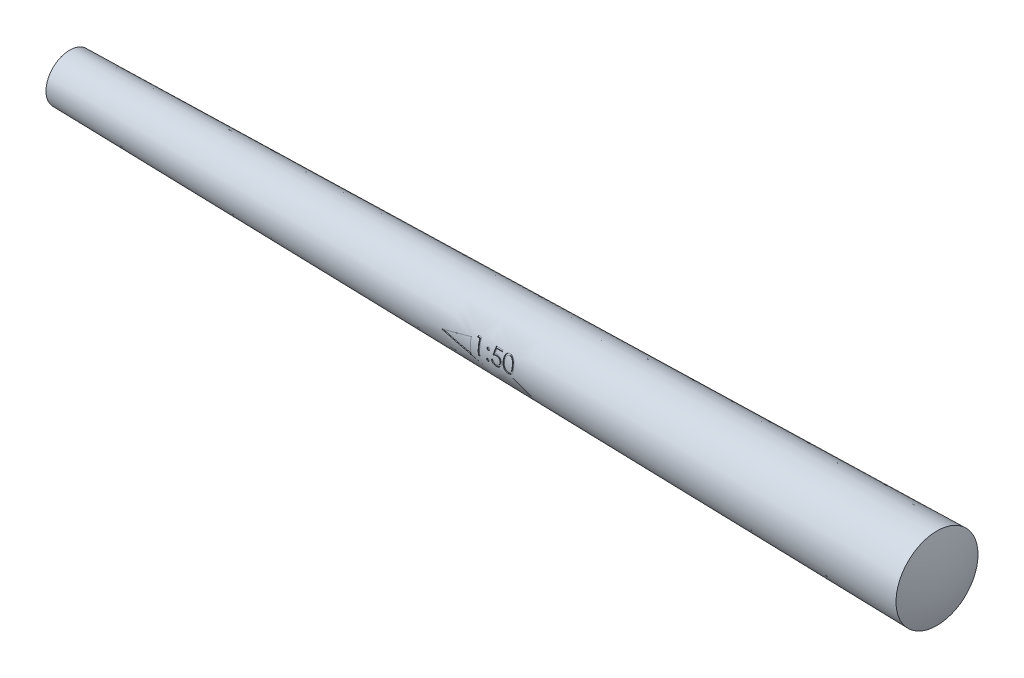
SolidWorks part; units mm, degrees
ref_plane "Front Plane" through (0, 0, 0) normal (0, 0, 1) x (1, 0, 0)
ref_plane "Top Plane" through (0, 0, 0) normal (0, 1, 0) x (1, 0, 0)
ref_plane "Right Plane" through (0, 0, 0) normal (1, 0, 0) x (0, 0, -1)
sketch "Sketch1" plane through (0, 0, 0) normal (1, 0, 0) x (0, 0, -1)
  circle A0 centre (0, 0) radius 1.5
  dimension "D1" = 3
extrude "Extrude1" add sketch "Sketch1" along normal mid plane 55
draft "Draft1" type of draft neutral plane draft angle 1.146 faces to draft 1 parameters "D1"=1.146
sketch "Sketch2" plane through (0, 0, 0) normal (0, 0, 1) x (1, 0, 0)
  line L0 (-27.5, 0) -> (-27.5, 1.5)
  line L1 (-27.5, 1.5) -> (-27.5, -1.5) construction
  line L2 (-27.5, 0) -> (-27.95, 0)
  line L3 (-27.95, 0) -> (-27.95, -2.05) construction
  line L4 (27.5, 0) -> (27.5, 2.6)
  line L5 (27.5, -2.6) -> (27.5, 2.6) construction
  line L6 (27.5, 0) -> (27.95, 0)
  line L7 (27.95, 0) -> (27.95, -2.05) construction
  line L8 (-27.5, -1.5) -> (27.5, -2.6) construction
  arc A0 (-27.95, 0) -> (-27.5, 1.5) centre (-25.225, 0) cw
  arc A1 (27.95, 0) -> (27.5, 2.6) centre (20.2137, 0) ccw
  point P14 (0, -2.05)
revolve "Revolve1" add sketch "Sketch2" angle 360 about L2
sketch "Sketch5" plane through (0, 0, 0) normal (0, 0, 1) x (1, 0, 0)
  line L0 (0, 2.05) -> (0, -2.05) construction
  line L1 (27.5, 2.6) -> (-27.5, 1.5) construction
  line L2 (-27.5, -1.5) -> (27.5, -2.6) construction
ref_plane "Plane2" through (0, 0, 0) normal (-0.02, 0, 0.9998) x (0.9998, 0, 0.02)
sketch "Sketch6" plane through (0, 0, 0) normal (-0.02, 0, 0.9998) x (0.9998, 0, 0.02)
  line L0 (0, 0) -> (0, 0.5)
  line L1 (0, 2.05) -> (0, -2.05) construction
  line L2 (0, 0.5) -> (-1.866, 0)
  line L3 (-1.866, 0) -> (0, -0.5)
  line L4 (0, -0.5) -> (0, 0)
  line L5 (0, -0.25) -> (3, -0.25) construction
  text T0 "1:50" font "Century Gothic" height 1
  dimension "D1" = 1
  dimension "D2" = 30
  dimension "D3" = 3
wrap "Wrap2" sketch "Sketch6" wrap type deboss source sketch "Sketch6" thickness 0.05 parameters "D1"=0.05
equation "\"D2@Sketch2\" = \"D1@Sketch2\""
